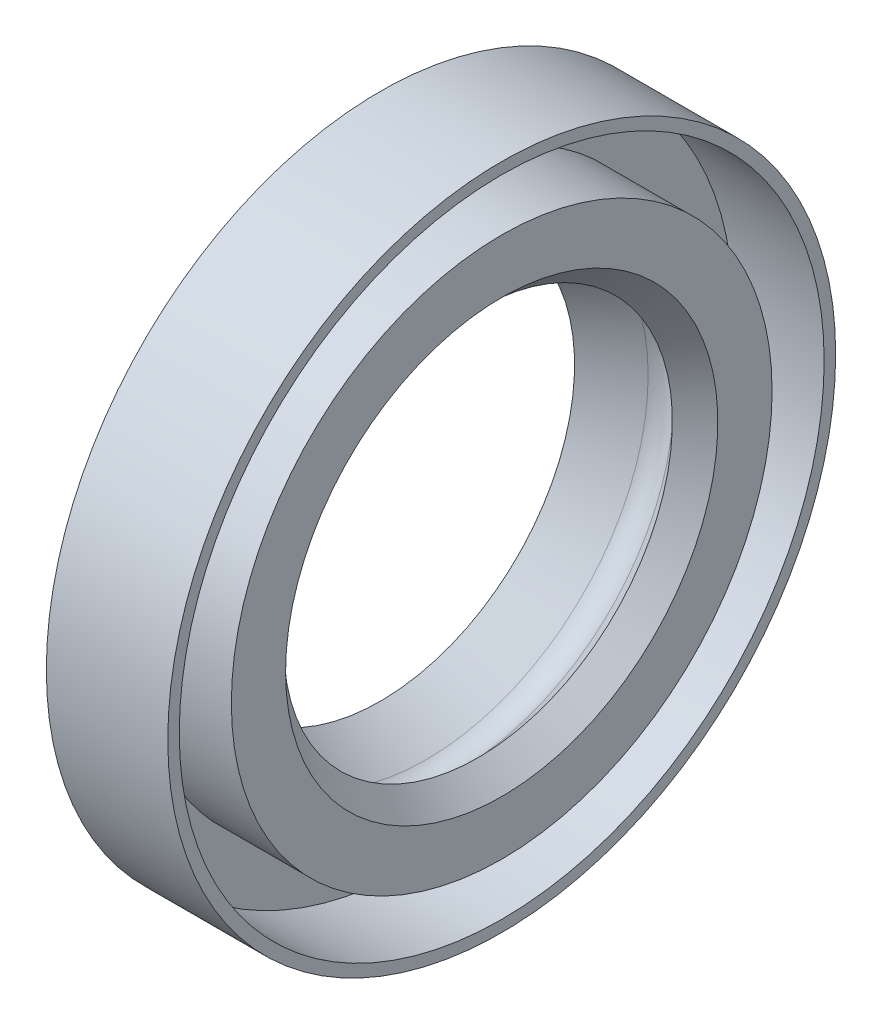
SolidWorks part; units mm, degrees
ref_plane "Plan1" through (0, 0, 0) normal (0, 0, 1) x (1, 0, 0)
ref_plane "Plan2" through (0, 0, 0) normal (0, 1, 0) x (1, 0, 0)
ref_plane "Plan3" through (0, 0, 0) normal (1, 0, 0) x (0, 0, -1)
sketch "Esquisse1" plane through (0, 0, 0) normal (0, 0, 1) x (1, 0, 0)
  line L0 (0, 19.5412) -> (0, 27.5)
  line L1 (0, 27.5) -> (10, 27.5)
  line L2 (0, 16) -> (0.8282, 17.7709)
  line L3 (10, 27.5) -> (10, 26.5533)
  line L4 (2.5, 26.5533) -> (10, 26.5533)
  line L5 (-2.0532, 0) -> (8.4305, 0) construction
  line L6 (0, 16) -> (3.7826, 18.2741)
  line L7 (2.5, 22.2648) -> (2.5, 26.5533)
  line L9 (10, 17.7984) -> (10, 22.2648)
  line L10 (10, 22.2648) -> (2.5, 22.2648)
  line L15 (8.0535, 16) -> (10, 17.7984)
  line L16 (8.0535, 16) -> (6.2821, 17.9173)
  line L17 (0, 19.5412) -> (0.8282, 17.7709)
  arc A0 (6.2821, 17.9173) -> (3.7826, 18.2741) centre (4.8131, 16.56) ccw
  dimension "D2" = 2
  dimension "D1" = 10
  dimension "D3" = 27.5
  dimension "D4" = 16
  dimension "D5" = 10
  dimension "D7" = 16
revolve "Base-Révolution" add sketch "Esquisse1" angle 360 about L5
